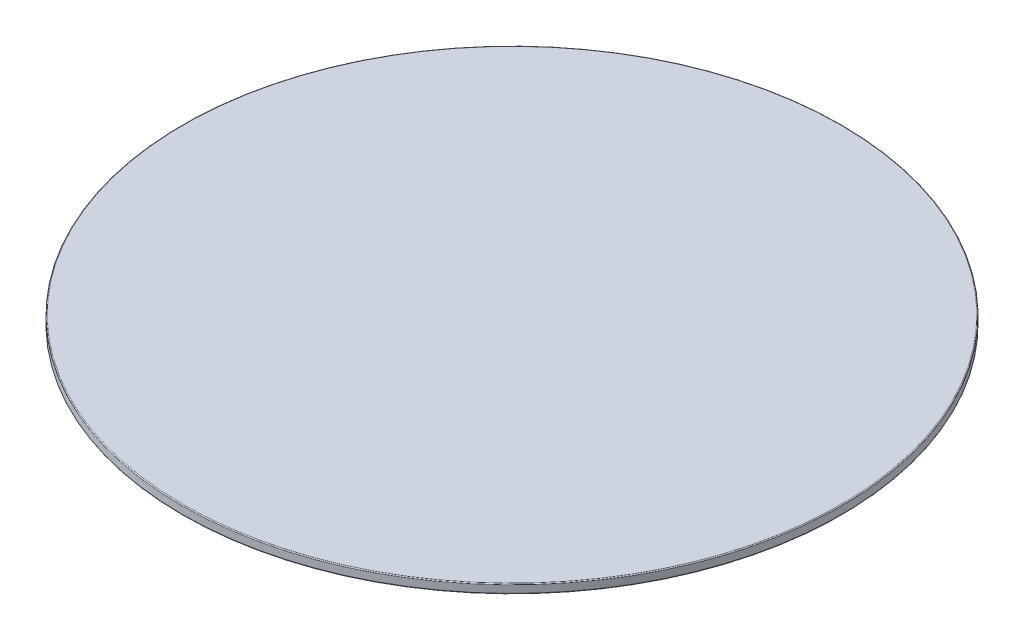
SolidWorks part; units mm, degrees
ref_plane "Alzado" through (0, 0, 0) normal (0, 0, 1) x (1, 0, 0)
ref_plane "Planta" through (0, 0, 0) normal (0, 1, 0) x (1, 0, 0)
ref_plane "Vista lateral" through (0, 0, 0) normal (1, 0, 0) x (0, 0, -1)
sketch "Croquis1" plane through (0, 0, 0) normal (0, 1, 0) x (1, 0, 0)
  circle A0 centre (0, 0) radius 72.5
extrude "Saliente-Extruir1" add sketch "Croquis1" along normal blind 2
fillet "Redondeo1" radius 0.2 2 edges at (0, 0, 72.5) (0, 2, 72.5)
sketch "Croquis2" plane through (0, 0, 0) normal (0, -1, 0) x (1, 0, 0)
  circle A0 centre (0, 0) radius 7.5
  circle A1 centre (0, 0) radius 11
  dimension "D1" = 22
  dimension "D2" = 15
extrude "Saliente-Extruir2" add sketch "Croquis2" along normal blind 4 contours A1 A0
fillet "Redondeo2" radius 0.2 3 edges at (0, 0, 11) (0, -4, -7.5) (0, -4, -11)
